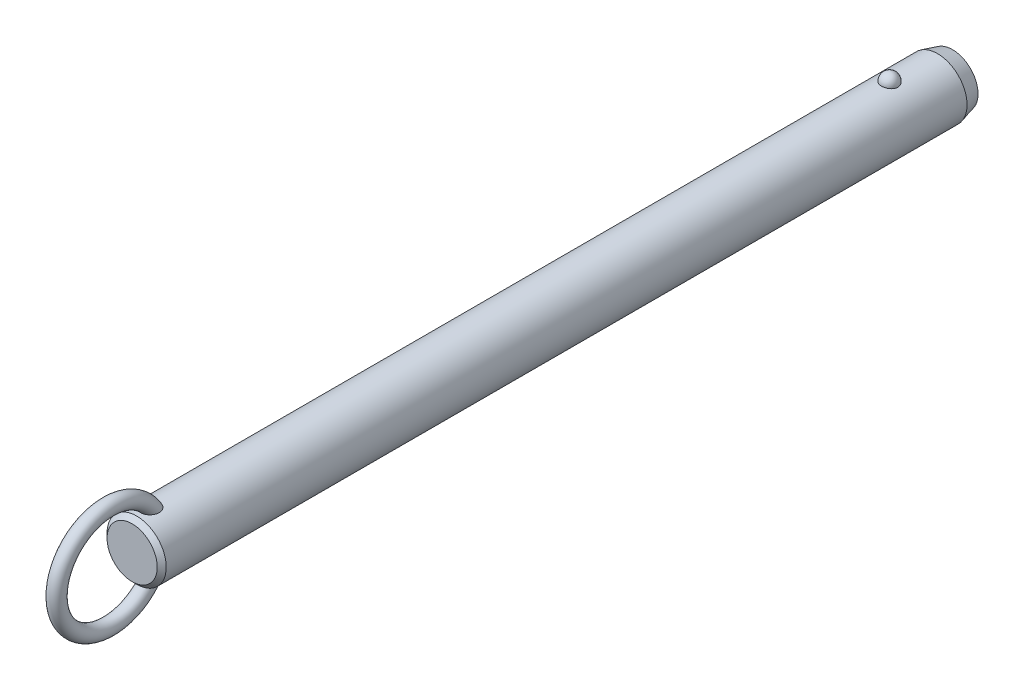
SolidWorks part; units mm, degrees
ref_plane "Front Plane" through (0, 0, 0) normal (0, 0, 1) x (1, 0, 0)
ref_plane "Top Plane" through (0, 0, 0) normal (0, 1, 0) x (1, 0, 0)
ref_plane "Right Plane" through (0, 0, 0) normal (1, 0, 0) x (0, 0, -1)
sketch "Sketch2" plane through (0, 0, 0) normal (0, 0, 1) x (1, 0, 0)
  circle A0 centre (0, 0) radius 7.9
  point P3 (0, 7.9)
  dimension "D1" = 15.8
extrude "Boss-Extrude1" add sketch "Sketch2" along normal blind 190.5
sketch "Sketch3" plane through (0, 0, 0) normal (0, 0, -1) x (-1, 0, 0)
  circle A0 centre (0, 0) radius 7.9
  dimension "D1" = 15.8
extrude "Boss-Extrude2" add sketch "Sketch3" along normal blind 19
chamfer "Chamfer1" distance 4 angle 15 1 edges at (-7.9, 0, -19)
sketch "Sketch12" plane through (0, 0, 0) normal (1, 0, 0) x (0, 0, -1)
  line L0 (-190.5, 7.9) -> (-190.5, -7.9) construction
  point P0 (-190.5, 0)
sketch "Sketch13" plane through (0, 0, 0) normal (1, 0, 0) x (0, 0, -1)
  circle A0 centre (-206.35, 0) radius 15.85
  point P2 (-190.5, 0)
  dimension "D1" = 31.7
sketch "Sketch14" plane through (0, 0, 0) normal (0, 1, 0) x (1, 0, 0)
  circle A0 centre (0, -192.5) radius 2
  point P2 (0, -190.5)
  dimension "D1" = 4
sweep "Sweep1" add profiles "Sketch14" path "Sketch13"
sketch "Sketch15" plane through (0, 0, 190.5) normal (0, 0, 1) x (1, 0, 0)
  circle A0 centre (0, 0) radius 7.9
  dimension "D1" = 15.8
extrude "Boss-Extrude3" add sketch "Sketch15" along normal blind 9.52
chamfer "Chamfer2" distance 1.2 angle 45 1 edges at (7.9, 0, 200.02)
sketch "Sketch18" plane through (0, 0, 0) normal (1, 0, 0) x (0, 0, -1)
  line L0 (15, 7.9) -> (-192.6091, 7.9) construction
  line L1 (2.2, 10.1) -> (2.2, 5.7)
  line L2 (-192.6091, -7.9) -> (15, -7.9) construction
  arc A0 (2.2, 10.1) -> (2.2, 5.7) centre (2.2, 7.9) ccw
  point P4 (0, 7.9)
  dimension "D1" = 18
revolve "Revolve1" add sketch "Sketch18" angle 360 about L1
